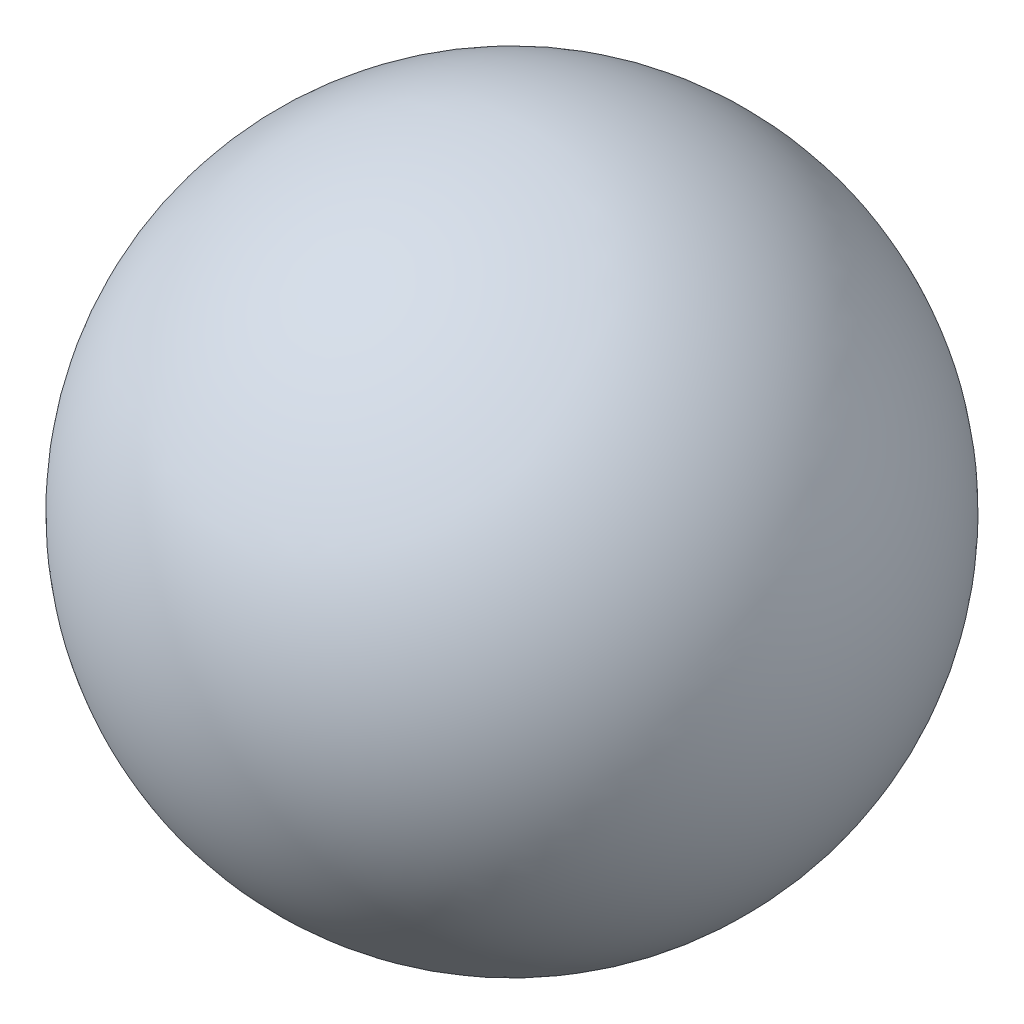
SolidWorks part; units mm, degrees
ref_plane "Front Plane" through (0, 0, 0) normal (0, 0, 1) x (1, 0, 0)
ref_plane "Top Plane" through (0, 0, 0) normal (0, 1, 0) x (1, 0, 0)
ref_plane "Right Plane" through (0, 0, 0) normal (1, 0, 0) x (0, 0, -1)
sketch "Sketch1" plane through (0, 0, 0) normal (0, 1, 0) x (1, 0, 0)
  line L0 (0, 1.3318) -> (0, -0.6062) construction
  line L1 (0, -1.5875) -> (0, 1.5875)
  arc A0 (0, 1.5875) -> (0, -1.5875) centre (0, 0) ccw
  dimension "D1" = 3.175
revolve "Revolve4" add sketch "Sketch1" angle 360 about L0
